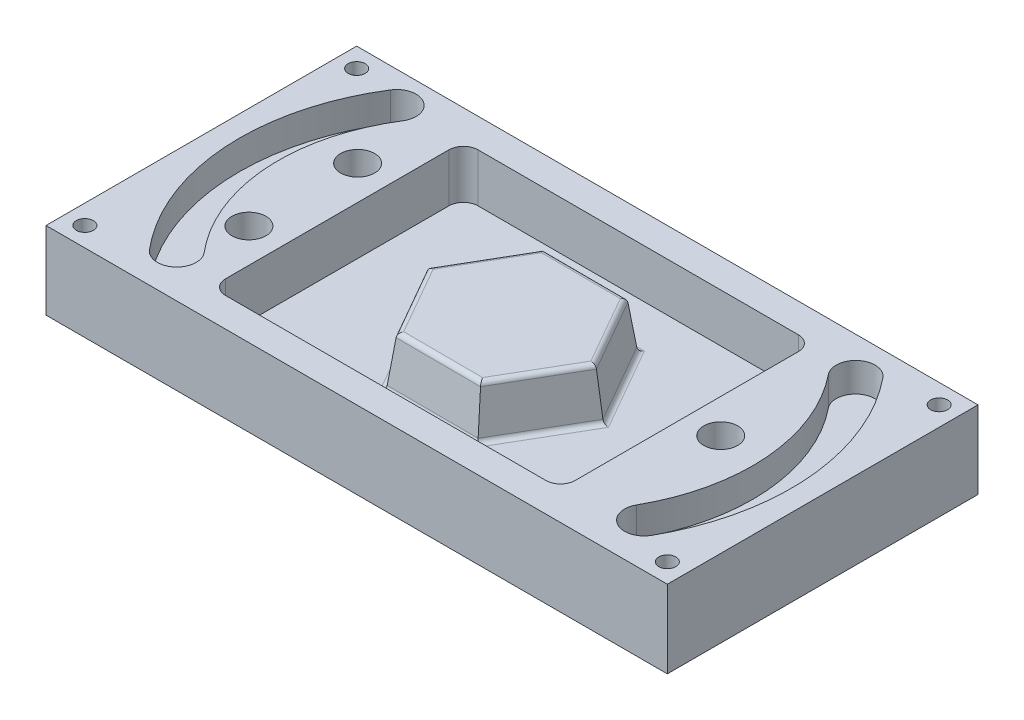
SolidWorks part; units mm, degrees
ref_plane "Front Plane" through (0, 0, 0) normal (0, 0, 1) x (1, 0, 0)
ref_plane "Top Plane" through (0, 0, 0) normal (0, 1, 0) x (1, 0, 0)
ref_plane "Right Plane" through (0, 0, 0) normal (1, 0, 0) x (0, 0, -1)
sketch "Sketch1" plane through (0, 0, 0) normal (0, 1, 0) x (1, 0, 0)
  line L1 (-203.2, 101.6) -> (203.2, 101.6)
  line L2 (-203.2, 101.6) -> (-203.2, -101.6)
  line L3 (-203.2, -101.6) -> (203.2, -101.6)
  line L4 (203.2, 101.6) -> (203.2, -101.6)
  dimension "D1" = 203.2
  dimension "D2" = 406.4
  dimension "D3" = 203.2
  dimension "D4" = 101.6
extrude "Boss-Extrude1" add sketch "Sketch1" along normal blind 50.8
sketch "Sketch3" plane through (0, 50.8, 0) normal (0, 1, 0) x (1, 0, 0)
  arc A0 (-145.8494, -73.3892) -> (-156.5716, 81.1368) centre (-45.519, 11.2075) cw construction
  arc A1 (-167.3184, 87.904) -> (-155.5586, -81.5758) centre (-45.519, 11.2075) ccw
  arc A2 (-145.8248, 74.3695) -> (-136.1402, -65.2026) centre (-45.519, 11.2075) ccw
  arc A3 (-145.8248, 74.3695) -> (-167.3184, 87.904) centre (-156.5716, 81.1368) ccw
  arc A4 (-155.5586, -81.5758) -> (-136.1402, -65.2026) centre (-145.8494, -73.3892) ccw
  arc A5 (159.2935, -72.9363) -> (146.9912, 77.7671) centre (42.1486, -6.6453) ccw construction
  arc A6 (170.3464, -79.1911) -> (156.8834, 85.7317) centre (42.1486, -6.6453) ccw
  arc A7 (148.2405, -66.6816) -> (137.099, 69.8025) centre (42.1486, -6.6453) ccw
  arc A8 (148.2405, -66.6816) -> (170.3464, -79.1911) centre (159.2935, -72.9363) ccw
  arc A9 (156.8834, 85.7317) -> (137.099, 69.8025) centre (146.9912, 77.7671) ccw
  point P3 (-176.4398, 2.1232)
  point P8 (176.3033, 4.3061)
  dimension "D1" = 12.7
  dimension "D2" = 12.7
extrude "Cut-Extrude1" cut sketch "Sketch3" against normal blind 19.05
sketch "Sketch8" plane through (0, 50.8, 0) normal (0, 1, 0) x (1, 0, 0)
  line L1 (-114.3, 82.55) -> (114.3, 82.55)
  line L2 (-114.3, 82.55) -> (-114.3, -82.55)
  line L3 (-114.3, -82.55) -> (114.3, -82.55)
  line L4 (114.3, 82.55) -> (114.3, -82.55)
  line L5 (27.3163, -47.7285) -> (54.9922, -0.2076)
  line L6 (54.9922, -0.2076) -> (27.6759, 47.5208)
  line L7 (27.6759, 47.5208) -> (-27.3163, 47.7285)
  line L8 (-27.3163, 47.7285) -> (-54.9922, 0.2076)
  line L9 (-54.9922, 0.2076) -> (-27.6759, -47.5208)
  line L10 (-27.6759, -47.5208) -> (27.3163, -47.7285)
  circle A0 centre (0, 0) radius 47.625 construction
  dimension "D5" = 95.25
  dimension "D1" = 165.1
  dimension "D2" = 228.6
  dimension "D3" = 82.55
  dimension "D4" = 114.3
  dimension "D6" = 47.625
extrude "Cut-Extrude3" cut sketch "Sketch8" against normal blind 31.75
draft "Draft3" type of draft neutral plane draft angle 8 faces to draft 6 parameters "D1"=8
fillet "Fillet1" radius 3.175 6 edges at (-41.1543, 50.8, -23.9681) (0.1798, 50.8, -47.6247) (41.3341, 50.8, -23.6566) (41.1543, 50.8, 23.9681) (-0.1798, 50.8, 47.6247) (-41.3341, 50.8, 23.6566)
fillet "Fillet2" radius 3.175 6 edges at (45.2068, 19.05, -25.8731) (0.1967, 19.05, -52.0868) (-45.0102, 19.05, -26.2137) (-45.2068, 19.05, 25.8731) (-0.1967, 19.05, 52.0868) (45.0102, 19.05, 26.2137)
fillet "Fillet3" radius 9.525 4 edges at (-114.3, 34.925, 82.55) (114.3, 34.925, 82.55) (114.3, 34.925, -82.55) (-114.3, 34.925, -82.55)
sketch "Sketch9" plane through (0, 50.8, 0) normal (0, 1, 0) x (1, 0, 0)
  line L0 (203.2, 101.6) -> (-203.2, 101.6) construction
  line L1 (-203.2, 101.6) -> (-203.2, -101.6) construction
  line L2 (-203.2, -101.6) -> (203.2, -101.6) construction
  line L3 (203.2, -101.6) -> (203.2, 101.6) construction
  circle A0 centre (-190.5, 88.9) radius 5.5563
  circle A1 centre (-190.5, -88.9) radius 5.5563
  circle A2 centre (190.5, -88.9) radius 5.5563
  circle A3 centre (190.5, 88.9) radius 5.5563
  circle A4 centre (-136.525, 35.56) radius 11.1125
  circle A5 centre (-136.525, -35.56) radius 11.1125
  circle A6 centre (136.525, 0) radius 11.1125
  dimension "D1" = 11.1125
  dimension "D2" = 11.1125
  dimension "D3" = 11.1125
  dimension "D4" = 11.1125
  dimension "D13" = 22.225
  dimension "D14" = 22.225
  dimension "D15" = 22.225
  dimension "D5" = 12.7
  dimension "D6" = 12.7
  dimension "D7" = 12.7
  dimension "D8" = 12.7
  dimension "D9" = 12.7
  dimension "D10" = 12.7
  dimension "D11" = 12.7
  dimension "D12" = 12.7
  dimension "D16" = 136.525
  dimension "D17" = 136.525
  dimension "D18" = 35.56
  dimension "D19" = 35.56
  dimension "D20" = 136.525
extrude "Cut-Extrude4" cut sketch "Sketch9" against normal through all
sketch "Sketch10" plane through (0, 50.8, 0) normal (0, 1, 0) x (1, 0, 0)
  point P0 (-170.7874, 50.7025)
